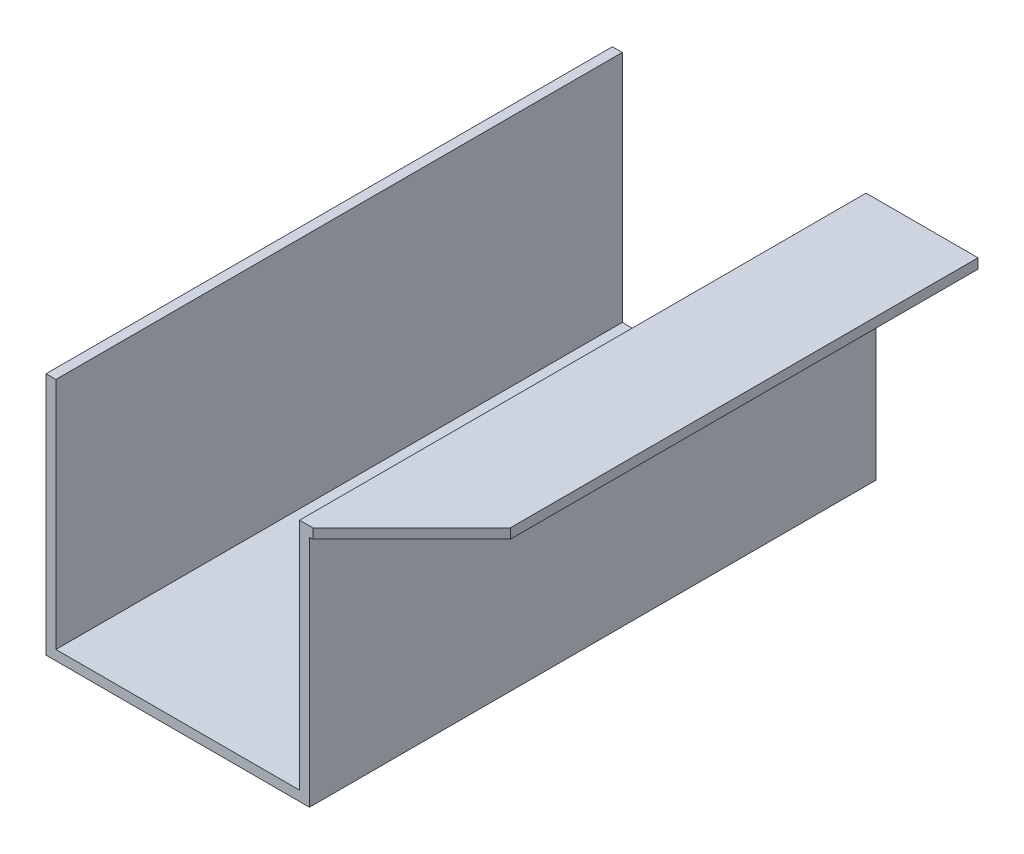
SolidWorks part; units mm, degrees
ref_plane "Plan de face" through (0, 0, 0) normal (0, 0, 1) x (1, 0, 0)
ref_plane "Plan de dessus" through (0, 0, 0) normal (0, 1, 0) x (1, 0, 0)
ref_plane "Plan de droite" through (0, 0, 0) normal (1, 0, 0) x (0, 0, -1)
sketch "Esquisse1" plane through (0, 0, 0) normal (0, 0, 1) x (1, 0, 0)
  line L0 (0, 0) -> (0, -35.5)
  line L1 (0, -35.5) -> (37, -35.5)
  line L2 (37, -35.5) -> (37, 0)
  line L3 (37, 0) -> (54, 0)
  line L4 (-1.5, 0) -> (-1.5, -37)
  line L5 (-1.5, -37) -> (38.5, -37)
  line L6 (38.5, -37) -> (38.5, -1.5)
  line L7 (38.5, -1.5) -> (54, -1.5)
  line L8 (-1.5, 0) -> (0, 0)
  line L9 (54, -1.5) -> (54, 0)
  dimension "D2" = 40
  dimension "D3" = 37
  dimension "D4" = 37
  dimension "D5" = 17
  dimension "D1" = 1.5
extrude "Extrusion1" add sketch "Esquisse1" along normal blind 86
chamfer "Chanfrein1" distance 15 distance2 15 1 edges at (54, -0.75, 86)
